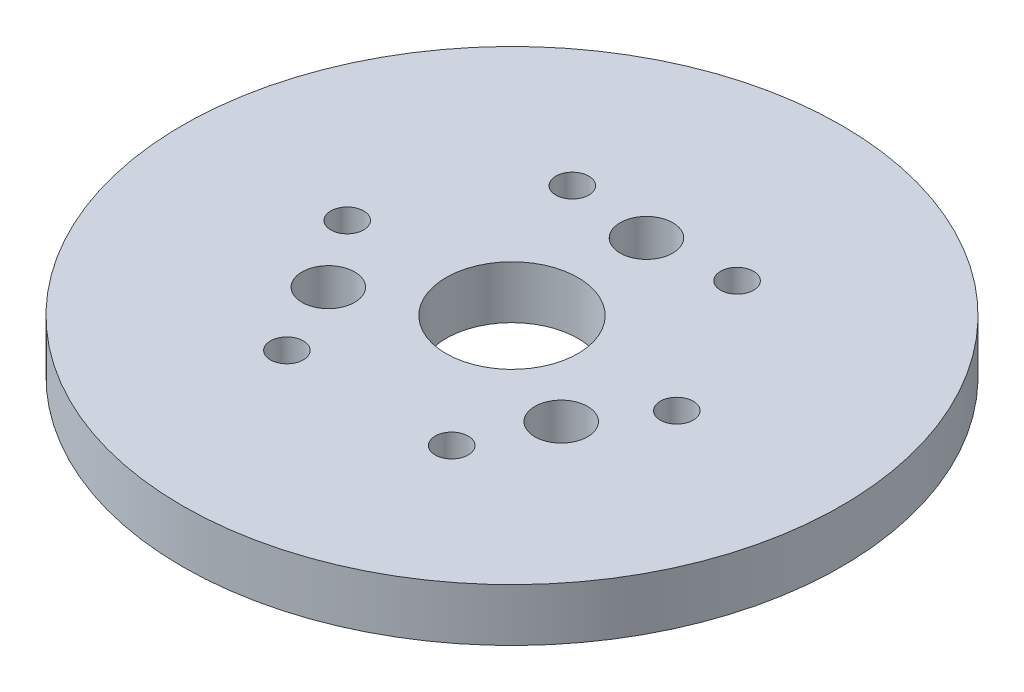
SolidWorks part; units mm, degrees
ref_plane "Front Plane" through (0, 0, 0) normal (0, 0, 1) x (1, 0, 0)
ref_plane "Top Plane" through (0, 0, 0) normal (0, 1, 0) x (1, 0, 0)
ref_plane "Right Plane" through (0, 0, 0) normal (1, 0, 0) x (0, 0, -1)
sketch "Sketch1" plane through (0, 0, 0) normal (0, 1, 0) x (1, 0, 0)
  circle A0 centre (0, 0) radius 25
extrude "Boss-Extrude1" add sketch "Sketch1" along normal blind 4 contours A0
sketch "Sketch6" plane through (0, 4, 0) normal (0, 1, 0) x (1, 0, 0)
  circle A0 centre (0, 0) radius 5
extrude "Cut-Extrude3" cut sketch "Sketch6" against normal blind 20.7
sketch "Sketch7" plane through (0, 4, 0) normal (0, 1, 0) x (1, 0, 0)
  line L0 (0, 12.5) -> (0, 0)
  circle A0 centre (0, 0) radius 12.5
  circle A1 centre (0, 0) radius 10.2
  circle A2 centre (-6.25, 10.8253) radius 1.25
  circle A3 centre (6.25, 10.8253) radius 1.25
  circle A4 centre (12.5, 0) radius 1.25
  circle A5 centre (6.25, -10.8253) radius 1.25
  circle A6 centre (-6.25, -10.8253) radius 1.25
  circle A7 centre (-12.5, 0) radius 1.25
  circle A8 centre (0, 10.2) radius 2
  circle A9 centre (8.8335, -5.1) radius 2
  circle A10 centre (-8.8335, -5.1) radius 2
  point P20 (0, 0)
  point P26 (0, 0)
  dimension "D1" = 25
  dimension "D2" = 20.4
  dimension "D3" = 12.5
  dimension "D4" = 6.25
  dimension "D6" = 3
  dimension "D5" = 3
extrude "Cut-Extrude4" cut sketch "Sketch7" against normal blind 10 contours A2 | A8 | A3 | A4 | A9 | A5 | A6 | A10 | A7
